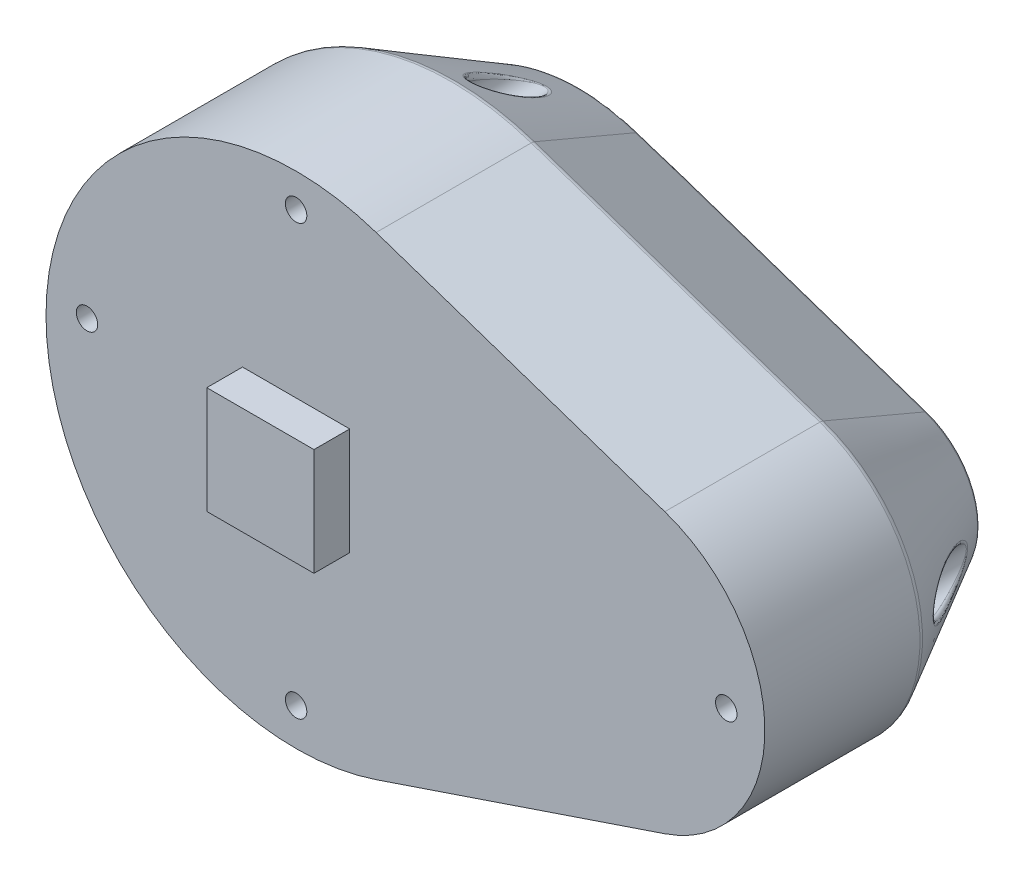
SolidWorks part; units mm, degrees
ref_plane "Płaszczyzna przednia" through (0, 0, 0) normal (0, 0, 1) x (1, 0, 0)
ref_plane "Płaszczyzna górna" through (0, 0, 0) normal (0, 1, 0) x (1, 0, 0)
ref_plane "Płaszczyzna prawa" through (0, 0, 0) normal (1, 0, 0) x (0, 0, -1)
sketch "Szkic2" plane through (0, 0, 0) normal (0, 0, 1) x (1, 0, 0)
  line L0 (72.584, 36.5336) -> (-8.2, 63.8192)
  line L1 (59.4, -2.5) -> (-30.6, -2.5) construction
  line L2 (72.584, -41.5336) -> (-8.2, -68.8192)
  line L3 (-20.6, 72.5) -> (72.584, 72.5)
  line L4 (72.584, 72.5) -> (72.584, 36.5336)
  circle A0 centre (-30.6, -2.5) radius 70
  circle A1 centre (59.4, -2.5) radius 41.2
  spline S0 degree 2 poles (-30.6, 67.5) (-24.5145, 68.061) (-20.6, 72.5) knots 0 0 0 1 1 1
  dimension "D1" = 140
  dimension "D2" = 90
extrude "Dodanie-wyciągnięcie1" add sketch "Szkic2" against normal blind 80
sketch "Szkic4" plane through (0, 0, 0) normal (0, 0, 1) x (1, 0, 0)
  line L0 (-30.6, 67.5) -> (-30.6, -72.5) construction
  line L2 (-45.6, 12.5) -> (-15.6, 12.5)
  line L3 (-45.6, 12.5) -> (-45.6, -17.5)
  line L4 (-45.6, -17.5) -> (-15.6, -17.5)
  line L5 (-15.6, 12.5) -> (-15.6, -17.5)
  line L6 (-45.6, 12.5) -> (-15.6, -17.5) construction
  line L7 (-45.6, -17.5) -> (-15.6, 12.5) construction
  arc A0 (-8.2, 63.8192) -> (-8.2, -68.8192) centre (-30.6, -2.5) ccw construction
  point P6 (-30.6, -2.5)
  dimension "D1" = 30
  dimension "D2" = 30
extrude "Dodanie-wyciągnięcie2" add sketch "Szkic4" along normal blind 10
chamfer "Sfazowanie1" distance 20 angle 61 4 edges at (32.192, -55.1764, -80) (100.6, -2.5, -80) (-100.6, -2.5, -80) (32.192, 50.1764, -80)
ref_plane "Płaszczyzna1" through (-30.6, 0, 0) normal (1, 0, 0) x (0, 0, -1)
sketch "Szkic8" plane through (-30.6, 0, 0) normal (1, 0, 0) x (0, 0, -1)
  line L0 (80, 47.5) -> (80, -2.5)
  line L1 (80, -52.5) -> (80, 47.5) construction
  line L2 (80, -2.5) -> (75.8148, -2.5)
  spline S0 degree 2 poles (80, 47.5) (75.8148, 22.5) (75.8148, -2.5) knots 0 0 0 0.5 0.5 0.5
revolve "Wycięcie-obrót2" cut sketch "Szkic8" angle 360 about L2
ref_plane "Płaszczyzna2" through (0, 0, -80) normal (0, 0, 1) x (1, 0, 0)
sketch "Szkic12" plane through (0, 0, -80) normal (0, 0, 1) x (1, 0, 0)
  line L0 (89.7917, -2.5) -> (-89.1266, 2.5) construction
  circle A0 centre (89.7917, -2.5) radius 5
  circle A1 centre (-89.1266, 2.5) radius 5
extrude "Wytnij-wyciągnięcie2" cut sketch "Szkic12" along normal blind 45
sketch "Szkic14" plane through (0, 0, -80) normal (0, 0, 1) x (1, 0, 0)
  circle A0 centre (89.7917, -2.5) radius 3
  circle A1 centre (-89.1266, 2.5) radius 3
extrude "Wytnij-wyciągnięcie3" cut sketch "Szkic14" along normal up to next
sketch "Szkic15" plane through (0, 0, -80) normal (0, 0, 1) x (1, 0, 0)
  line L0 (-30.6, -49.5) -> (-30.6, 49.5) construction
  circle A0 centre (-30.6, 58.1371) radius 5
  circle A1 centre (-30.6, -62.0286) radius 5
extrude "Wytnij-wyciągnięcie4" cut sketch "Szkic15" along normal blind 45
sketch "Szkic16" plane through (0, 0, -80) normal (0, 0, 1) x (1, 0, 0)
  circle A0 centre (-30.6, 58.1371) radius 3
  circle A1 centre (-30.6, -62.0286) radius 3
extrude "Wytnij-wyciągnięcie5" cut sketch "Szkic16" along normal up to next
fillet "Zaokrąglenie2" radius 2 4 edges at (-80.6, -2.5, -80) (25.792, -36.2281, -80) (80.6, -2.5, -80) (25.792, 31.2281, -80)
fillet "Zaokrąglenie3" radius 2 3 edges at (-3.8624, 40.6994, -79.8873) (-3.8624, -45.6994, -79.8873) (19.4, -2.5, -80)
fillet "Zaokrąglenie4" radius 2 4 edges at (100.6, -2.5, -43.919) (32.192, -55.1764, -43.919) (-100.6, -2.5, -43.919) (32.192, 50.1764, -43.919)
fillet "Zaokrąglenie5" radius 1 4 edges at (93.4109, 0.9499, -56.5737) (-27.9494, -66.2682, -55.0621) (-93.5656, 4.8012, -55.8483) (-27.8995, 62.3451, -53.1173)
